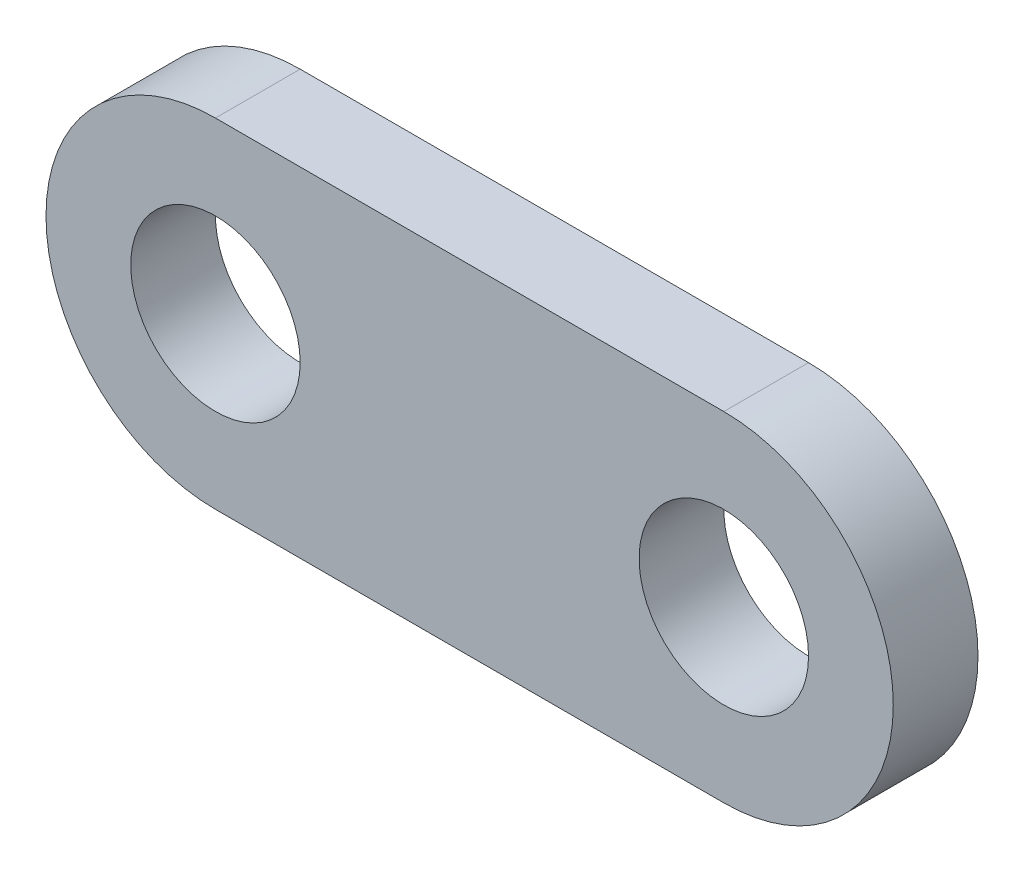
SolidWorks part; units mm, degrees
ref_plane "Front" through (0, 0, 0) normal (0, 0, 1) x (1, 0, 0)
ref_plane "Top" through (0, 0, 0) normal (0, 1, 0) x (1, 0, 0)
ref_plane "Right" through (0, 0, 0) normal (1, 0, 0) x (0, 0, -1)
sketch "Sketch1" plane through (0, 0, 0) normal (0, 0, 1) x (1, 0, 0)
  line L0 (19.05, 12.7) -> (-19.05, -12.7) construction
  line L1 (-19.05, 12.7) -> (19.05, 12.7)
  line L2 (-19.05, 12.7) -> (-19.05, -12.7) construction
  line L3 (-19.05, -12.7) -> (19.05, -12.7)
  line L4 (19.05, 12.7) -> (19.05, -12.7) construction
  arc A0 (-19.05, -12.7) -> (-19.05, 12.7) centre (-19.05, 0) cw
  arc A1 (19.05, 12.7) -> (19.05, -12.7) centre (19.05, 0) cw
  circle A2 centre (19.05, 0) radius 6.35
  circle A3 centre (-19.05, 0) radius 6.35
  dimension "D3" = 12.7
  dimension "D4" = 12.7
  dimension "D1" = 38.1
  dimension "D2" = 25.4
extrude "Extrude1" add sketch "Sketch1" along normal blind 6.35
